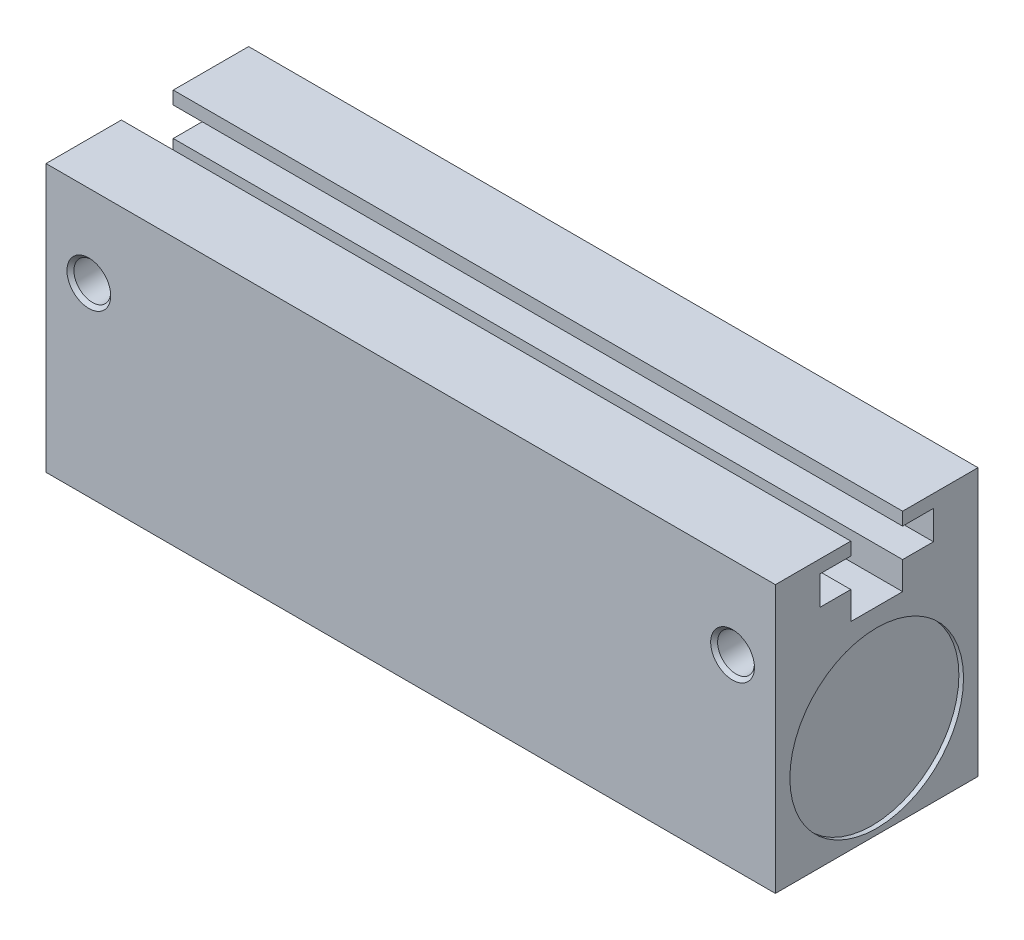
SolidWorks part; units mm, degrees
ref_plane "Front Plane" through (0, 0, 0) normal (0, 0, 1) x (1, 0, 0)
ref_plane "Top Plane" through (0, 0, 0) normal (0, 1, 0) x (1, 0, 0)
ref_plane "Right Plane" through (0, 0, 0) normal (1, 0, 0) x (0, 0, -1)
sketch "Sketch1" plane through (0, 0, 0) normal (1, 0, 0) x (0, 0, -1)
  line L0 (-11.1125, -14.6685) -> (11.1125, -14.6685)
  line L1 (11.1125, -14.6685) -> (11.1125, 14.6685)
  line L2 (11.1125, 14.6685) -> (2.8448, 14.6685)
  line L3 (2.8448, 14.6685) -> (2.8448, 13.2461)
  line L4 (2.8448, 13.2461) -> (6.223, 13.2461)
  line L5 (6.223, 13.2461) -> (6.223, 10.0711)
  line L6 (6.223, 10.0711) -> (2.8448, 10.0711)
  line L7 (2.8448, 10.0711) -> (2.8448, 7.0231)
  line L8 (2.8448, 7.0231) -> (-2.8448, 7.0231)
  line L9 (-2.8448, 7.0231) -> (-2.8448, 10.0711)
  line L10 (-2.8448, 10.0711) -> (-6.223, 10.0711)
  line L11 (-6.223, 10.0711) -> (-6.223, 13.2461)
  line L12 (-6.223, 13.2461) -> (-2.8448, 13.2461)
  line L13 (-2.8448, 13.2461) -> (-2.8448, 14.6685)
  line L14 (-2.8448, 14.6685) -> (-11.1125, 14.6685)
  line L15 (-11.1125, 14.6685) -> (-11.1125, -14.6685)
  line L16 (-11.1125, 14.6685) -> (11.1125, -14.6685) construction
  point P16 (6.223, 11.6586)
  dimension "D1" = 22.225
  dimension "D2" = 29.337
  dimension "D3" = 5.6896
  dimension "D4" = 12.446
  dimension "D5" = 7.6454
  dimension "D6" = 3.175
  dimension "D7" = 3.0099
extrude "Extrude1" add sketch "Sketch1" along normal mid plane 80.01
sketch "Sketch10" plane through (-40.005, 0, 0) normal (1, 0, 0) x (0, 0, -1)
  line L0 (-11.1125, -14.6685) -> (11.1125, -14.6685) construction
  circle A0 centre (0, -4.5085) radius 9.525
  dimension "D1" = 19.05
  dimension "D2" = 10.16
extrude "Cut-Extrude1" cut sketch "Sketch10" along normal blind 0.508
mirror "Mirror1" about plane through (0, 0, 0) normal (1, 0, 0) of "Cut-Extrude1"
hole_wizard "#10-32 Tapped Hole1" positions "Sketch12" profile "Sketch11" tap size "#10-32" standard "ANSI Inch"
sketch "Sketch12" plane through (0, 0, 11.1125) normal (0, 0, 1) x (1, 0, 0)
  line L0 (-35.306, 5.6515) -> (35.306, 5.6515) construction
  line L2 (40.005, -14.6685) -> (-40.005, -14.6685) construction
  point P0 (-35.306, 5.6515)
  point P2 (35.306, 5.6515)
  point P9 (0, 5.6515)
  dimension "D1" = 70.612
  dimension "D2" = 20.32
sketch "Sketch11" plane through (-35.306, 5.6515, 11.1125) normal (1, 0, 0) x (0, -1, 0)
  line L0 (0, 0) -> (0, 6.1018)
  line L1 (0, 6.1018) -> (2.0193, 4.8885)
  line L2 (2.0193, 4.8885) -> (2.0193, 0)
  line L5 (2.0193, 0) -> (0, 0)
  line L10 (0, 6.1018) -> (-2.0193, 4.8885) construction
  line L11 (0, -6.35) -> (0, 107.95) construction
  dimension "Tap Drill Dia." = 4.0386
  dimension "Tap Drill Depth" = 4.8885
  dimension "Drill Angle" = 118
hole_wizard "#5-40 Tapped Hole1" positions "Sketch14" profile "Sketch13" tap size "#5-40" standard "ANSI Inch"
sketch "Sketch14" plane through (0, -14.6685, 0) normal (0, -1, 0) x (-1, 0, 0)
  point P0 (-12.7, 8.3312)
  point P2 (12.7, 8.3312)
  point P4 (12.7, -8.3312)
  point P6 (-12.7, -8.3312)
  dimension "D1" = 25.4
  dimension "D2" = 12.7
  dimension "D3" = 16.6624
  dimension "D4" = 8.3312
sketch "Sketch13" plane through (12.7, -14.6685, -8.3312) normal (1, 0, 0) x (0, 0, -1)
  line L0 (0, 0) -> (0, 7.4547)
  line L1 (0, 7.4547) -> (1.289, 6.6802)
  line L2 (1.289, 6.6802) -> (1.289, 0)
  line L5 (1.289, 0) -> (0, 0)
  line L10 (0, 7.4547) -> (-1.2891, 6.6802) construction
  line L11 (0, -6.35) -> (0, 107.95) construction
  dimension "Tap Drill Dia." = 2.5781
  dimension "Tap Drill Depth" = 6.6802
  dimension "Drill Angle" = 118
hole_wizard "Hole1" positions "Sketch16" profile "Sketch15" legacy
sketch "Sketch16" plane through (0, -14.6685, 0) normal (0, -1, 0) x (-1, 0, 0)
  point P0 (0, 8.3312)
  point P2 (0, -8.3312)
  dimension "D1" = 16.6624
  dimension "D2" = 8.3312
sketch "Sketch15" plane through (0, -14.6685, -8.3312) normal (1, 0, 0) x (0, 0, -1)
  line L0 (0, 0) -> (0, 7.3039)
  line L1 (0, 7.3039) -> (1.5875, 6.35)
  line L2 (1.5875, 6.35) -> (1.5875, 0)
  line L4 (1.5875, 0) -> (0, 0)
  line L6 (0, 7.3039) -> (-1.5875, 6.35) construction
  line L7 (0, -4.2442) -> (0, 117.3081) construction
  dimension "Diameter" = 3.175
  dimension "Depth" = 6.35
  dimension "Drill Angle" = 118
chamfer "Chamfer1" distance 0.381 angle 45 6 edges at (12.7, -14.6685, 7.0422) (12.7, -14.6685, -9.6203) (-12.7, -14.6685, -9.6203) (-12.7, -14.6685, 7.0422) (37.3253, 5.6515, 11.1125) (-33.2867, 5.6515, 11.1125)
